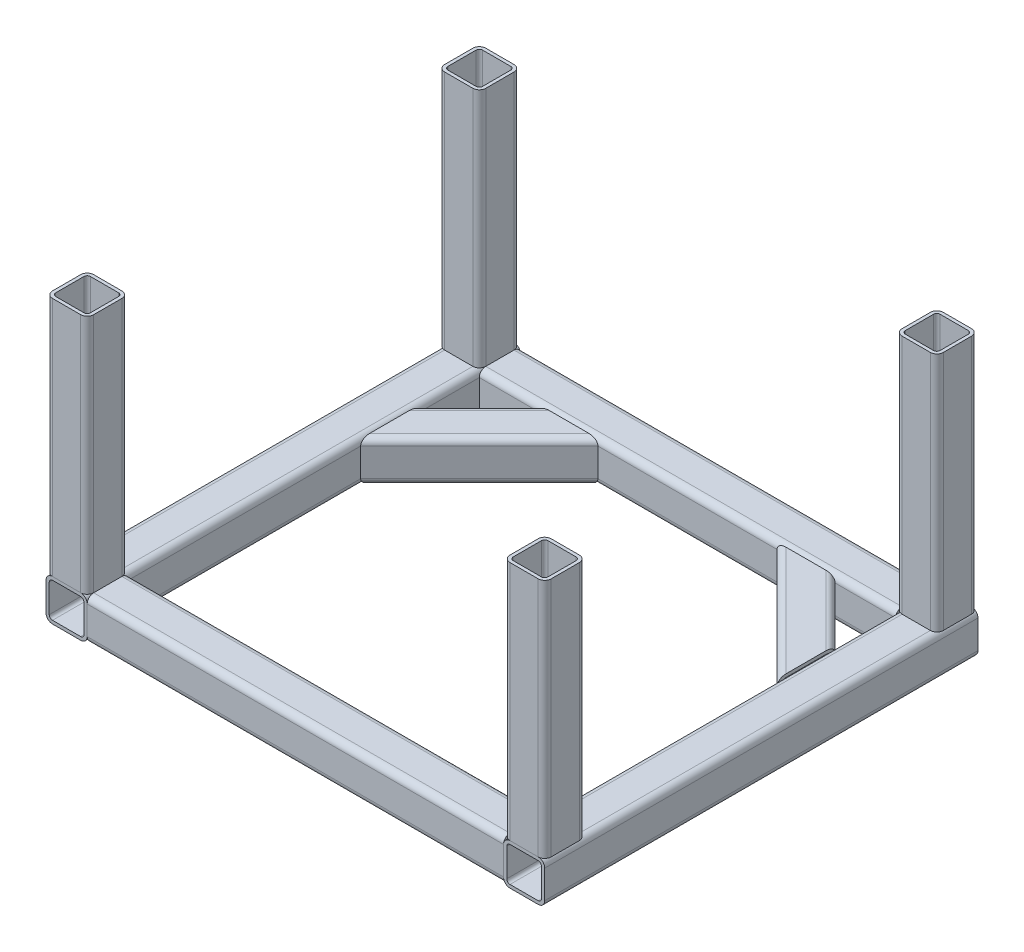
SolidWorks part; units mm, degrees
ref_plane "Front Plane" through (0, 0, 0) normal (0, 0, 1) x (1, 0, 0)
ref_plane "Top Plane" through (0, 0, 0) normal (0, 1, 0) x (1, 0, 0)
ref_plane "Right Plane" through (0, 0, 0) normal (1, 0, 0) x (0, 0, -1)
sketch "Sketch1" plane through (0, 0, 0) normal (0, 1, 0) x (1, 0, 0)
  line L1 (-444.5, 381) -> (444.5, 381)
  line L2 (-444.5, 381) -> (-444.5, -381)
  line L3 (-444.5, -381) -> (444.5, -381)
  line L4 (444.5, 381) -> (444.5, -381)
  line L6 (0, 381) -> (0, -381) construction
  dimension "D1" = 762
  dimension "D2" = 889
sketch "Sketch14" plane through (0, 0, 0) normal (0, 1, 0) x (1, 0, 0)
  line L0 (-190.5, 381) -> (-444.5, 127)
  line L1 (-444.5, 381) -> (444.5, 381) construction
  line L2 (-444.5, 381) -> (-444.5, -381) construction
  dimension "D1" = 254
  dimension "D2" = 45
sketch "Sketch15" plane through (0, 0, 0) normal (0, 1, 0) x (1, 0, 0)
  line L0 (190.5, 381) -> (444.5, 127)
  line L1 (-444.5, 381) -> (444.5, 381) construction
  line L2 (444.5, 381) -> (444.5, -381) construction
  line L3 (-190.5, 381) -> (-444.5, 127) construction
sketch3d "3DSketch1"
  line L0 (-444.5, 0, 381) -> (-444.5, 508, 381)
  line L1 (-444.5, 0, -381) -> (-444.5, 508, -381)
  line L2 (444.5, 0, -381) -> (444.5, 508, -381)
  line L3 (444.5, 0, 381) -> (444.5, 508, 381)
  dimension "D1" = 508
other "Structural Member1"
ref_plane "Plane1" through (444.5, 0, -381) normal (0, 0, 1) x (1, 0, 0)
sketch "Sketch17" plane through (444.5, 0, -381) normal (0, 0, 1) x (1, 0, 0)
  line L0 (-27.4, -33.7) -> (27.4, -33.7)
  line L1 (-33.7, -27.4) -> (-33.7, 27.4)
  line L2 (27.4, 33.7) -> (-27.4, 33.7)
  line L3 (33.7, 27.4) -> (33.7, -27.4)
  line L4 (-27.4, -40) -> (27.4, -40)
  line L5 (-40, -27.4) -> (-40, 27.4)
  line L6 (27.4, 40) -> (-27.4, 40)
  line L7 (40, 27.4) -> (40, -27.4)
  line L8 (-40, 0) -> (-33.7, 0) construction
  line L9 (-33.7, 0) -> (33.7, 0) construction
  line L10 (33.7, 0) -> (40, 0) construction
  line L12 (0, 40) -> (0, 33.7) construction
  line L13 (0, 33.7) -> (0, -33.7) construction
  line L14 (0, -33.7) -> (0, -40) construction
  arc A0 (40, 27.4) -> (27.4, 40) centre (27.4, 27.4) ccw
  arc A1 (27.4, -40) -> (40, -27.4) centre (27.4, -27.4) ccw
  arc A2 (-40, -27.4) -> (-27.4, -40) centre (-27.4, -27.4) ccw
  arc A3 (-27.4, 40) -> (-40, 27.4) centre (-27.4, 27.4) ccw
  arc A4 (-27.4, 33.7) -> (-33.7, 27.4) centre (-27.4, 27.4) ccw
  arc A5 (33.7, 27.4) -> (27.4, 33.7) centre (27.4, 27.4) ccw
  arc A6 (27.4, -33.7) -> (33.7, -27.4) centre (27.4, -27.4) ccw
  arc A7 (-33.7, -27.4) -> (-27.4, -33.7) centre (-27.4, -27.4) ccw
  point P2 (-40, 40)
  point P33 (-40, -40)
  point P34 (40, -40)
  point P36 (40, 40)
  point P37 (0, 0)
  dimension "D1" = 12.6
  dimension "Thickness" = 6.3
  dimension "V_leg" = 80
  dimension "H_leg" = 80
